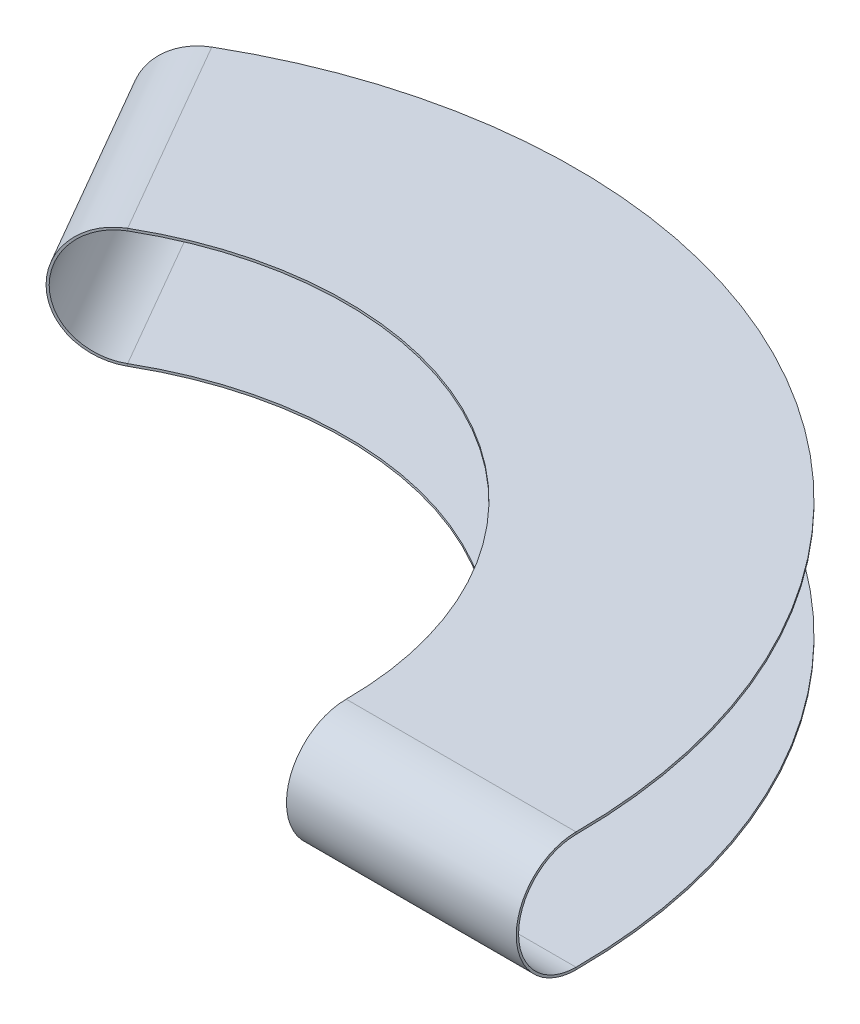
SolidWorks part; units mm, degrees
ref_plane "Vorne" through (0, 0, 0) normal (0, 0, 1) x (1, 0, 0)
ref_plane "Oben" through (0, 0, 0) normal (0, 1, 0) x (1, 0, 0)
ref_plane "Rechts" through (0, 0, 0) normal (1, 0, 0) x (0, 0, -1)
sketch "Skizze1" plane through (0, 0, 0) normal (0, 1, 0) x (1, 0, 0)
  line L0 (0, 0) -> (-150, 259.8076) construction
  line L1 (0, 0) -> (300, 0) construction
  line L2 (300, 0) -> (500, 0)
  line L3 (-250, 433.0127) -> (-150, 259.8076)
  arc A0 (300, 0) -> (-150, 259.8076) centre (0, 0) ccw
  arc A1 (500, 0) -> (-250, 433.0127) centre (0, 0) ccw
  dimension "Radius innen" = 300
  dimension "Winkel" = 120
  dimension "Bandbreite" = 200
extrude "Linear austragen1" add sketch "Skizze1" along normal blind 100
ref_plane "Ebene1" through (300, 100, 0) normal (1, 0, 0) x (0, 0, -1)
sketch "Skizze2" plane through (300, 100, 0) normal (1, 0, 0) x (0, 0, -1)
  line L0 (0, 0) -> (0, -100) construction
  line L1 (0, 0) -> (0, -100)
  arc A0 (0, -100) -> (0, 0) centre (0, -50) cw
extrude "Linear austragen2" add sketch "Skizze2" along normal through all
ref_plane "Ebene2" through (-150, 100, -259.8076) normal (0.5, 0, 0.866) x (0.866, 0, -0.5)
sketch "Skizze3" plane through (-150, 100, -259.8076) normal (0.5, 0, 0.866) x (0.866, 0, -0.5)
  line L0 (0, 0) -> (0, -100) construction
  line L1 (0, 0) -> (0, -100)
  arc A0 (0, 0) -> (0, -100) centre (0, -50) ccw
extrude "Linear austragen3" add sketch "Skizze3" against normal up to vertex (200 mm away)
shell "Wandung1" thickness 2
